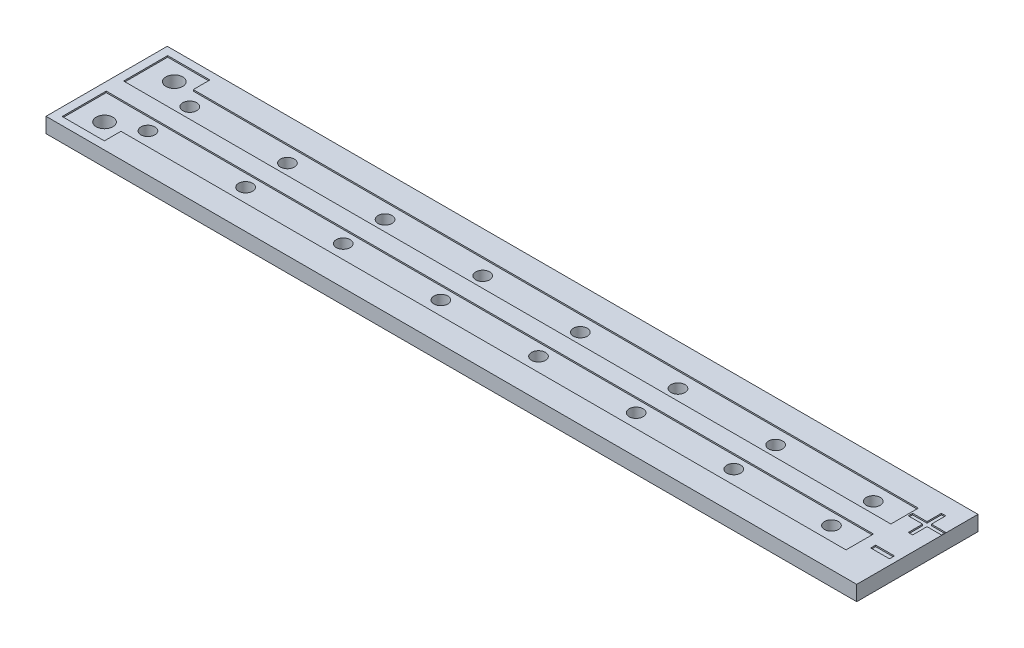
SolidWorks part; units mm, degrees
ref_plane "Plan de face" through (0, 0, 0) normal (0, 0, 1) x (1, 0, 0)
ref_plane "Plan de dessus" through (0, 0, 0) normal (0, 1, 0) x (1, 0, 0)
ref_plane "Plan de droite" through (0, 0, 0) normal (1, 0, 0) x (0, 0, -1)
sketch "Esquisse1" plane through (0, 0, 0) normal (0, 1, 0) x (1, 0, 0)
  line L0 (58.12, 4.3475) -> (0, 4.3475) construction
  line L1 (0, 0) -> (58.12, 0)
  line L2 (0, 0) -> (0, 8.695)
  line L3 (0, 8.695) -> (58.12, 8.695)
  line L4 (58.12, 0) -> (58.12, 8.695)
  line L5 (-1.7107, 5.8475) -> (62.2371, 5.8475) construction
  circle A0 centre (2.35, 6.8475) radius 0.6
  circle A1 centre (4.46, 5.8475) radius 0.5
  circle A2 centre (11.46, 5.8475) radius 0.5
  circle A3 centre (18.46, 5.8475) radius 0.5
  circle A4 centre (25.46, 5.8475) radius 0.5
  circle A5 centre (32.46, 5.8475) radius 0.5
  circle A6 centre (39.46, 5.8475) radius 0.5
  circle A7 centre (46.46, 5.8475) radius 0.5
  circle A8 centre (53.46, 5.8475) radius 0.5
  circle A9 centre (53.46, 2.8475) radius 0.5
  circle A10 centre (46.46, 2.8475) radius 0.5
  circle A11 centre (39.46, 2.8475) radius 0.5
  circle A12 centre (32.46, 2.8475) radius 0.5
  circle A13 centre (25.46, 2.8475) radius 0.5
  circle A14 centre (18.46, 2.8475) radius 0.5
  circle A15 centre (11.46, 2.8475) radius 0.5
  circle A16 centre (4.46, 2.8475) radius 0.5
  circle A17 centre (2.35, 1.8475) radius 0.6
  dimension "D4" = 1
  dimension "D5" = 1.2
  dimension "D1" = 58.12
  dimension "D2" = 8.695
  dimension "D3" = 1.5
  dimension "D6" = 2.35
  dimension "D7" = 4.46
  dimension "D8" = 2.5
extrude "Extrusion1" add sketch "Esquisse1" along normal blind 1.08
sketch "Esquisse2" plane through (0, 1.08, 0) normal (0, 1, 0) x (-1, 0, 0)
  line L0 (0, -4.3475) -> (-58.12, -4.3475) construction
  line L1 (-55.5972, -3.7248) -> (-0.5926, -3.7248)
  line L2 (-55.5972, -3.7248) -> (-55.5972, -1.7559)
  line L3 (-55.5972, -1.7559) -> (-3.6192, -1.7559)
  line L4 (0, -8.695) -> (0, 0) construction
  line L5 (-58.12, 0) -> (-58.12, -8.695) construction
  line L6 (-0.5926, -3.7248) -> (-0.5926, -0.5644)
  line L7 (-0.5926, -0.5644) -> (-3.6192, -0.5644)
  line L8 (-3.6192, -1.7559) -> (-3.6192, -0.5644)
  line L9 (-3.6192, -6.9392) -> (-3.6192, -8.1306)
  line L10 (-0.5926, -8.1306) -> (-3.6192, -8.1306)
  line L11 (-0.5926, -4.9702) -> (-0.5926, -8.1306)
  line L12 (-55.5972, -6.9392) -> (-3.6192, -6.9392)
  line L13 (-55.5972, -4.9702) -> (-55.5972, -6.9392)
  line L14 (-55.5972, -4.9702) -> (-0.5926, -4.9702)
  text T0 "+"
  text T1 "-"
extrude "Enlèv. mat.-Extru.1" cut sketch "Esquisse2" against normal blind 0.1
